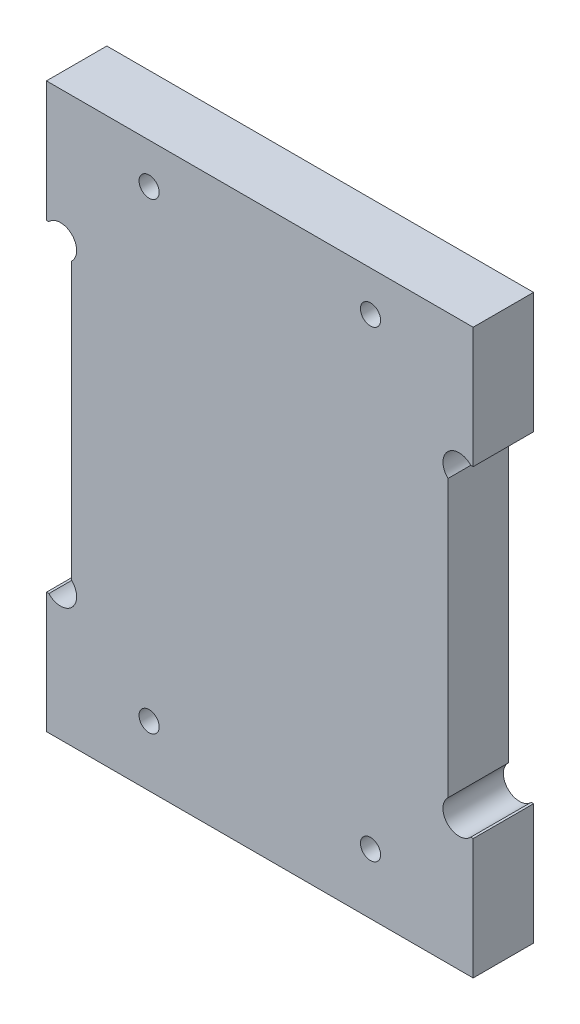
SolidWorks part; units mm, degrees
ref_plane "Plan de face" through (0, 0, 0) normal (0, 0, 1) x (1, 0, 0)
ref_plane "Plan de dessus" through (0, 0, 0) normal (0, 1, 0) x (1, 0, 0)
ref_plane "Plan de droite" through (0, 0, 0) normal (1, 0, 0) x (0, 0, -1)
sketch "Esquisse1" plane through (0, 0, 0) normal (0, 0, 1) x (1, 0, 0)
  line L0 (0, 41.289) -> (0, -35.1803) construction
  line L1 (-15, 27) -> (15, 27) construction
  line L2 (-15, 27) -> (-15, -27) construction
  line L3 (-15, -27) -> (15, -27) construction
  line L4 (15, 27) -> (15, -27) construction
  line L5 (-15, 27) -> (15, -27) construction
  line L6 (-15, -27) -> (15, 27) construction
  line L7 (-34.1389, 0) -> (26.846, 0) construction
  line L8 (-35.4491, -29) -> (54.1224, -29) construction
  line L9 (18.7, 32.9512) -> (18.7, -35.1803) construction
  line L10 (24.7, 34.7726) -> (24.7, -34.2274) construction
  line L11 (-23.2998, 27) -> (36.494, 27) construction
  line L12 (11, 15) -> (36.494, 15) construction
  line L13 (9.4444, -17) -> (55.5518, -17) construction
  line L14 (-24.7, 27) -> (24.7, 27)
  line L15 (24.7, 27) -> (24.7, 15)
  line L16 (24.7, 15) -> (20.9619, 15)
  line L17 (18.7, 12.7381) -> (18.7, -14.7381)
  line L18 (20.9619, -17) -> (24.7, -17)
  line L19 (24.7, -17) -> (24.7, -29)
  line L20 (24.7, -29) -> (-24.7, -29)
  line L21 (-24.7, 27) -> (-24.7, 15)
  line L22 (-24.7, 15) -> (-20.9619, 15)
  line L23 (-18.7, 12.7381) -> (-18.7, -14.7381)
  line L24 (-20.9619, -17) -> (-24.7, -17)
  line L25 (-24.7, -17) -> (-24.7, -29)
  circle A0 centre (-11, 23) radius 1
  circle A1 centre (11, 23) radius 1
  circle A2 centre (-11, -23) radius 1
  circle A3 centre (11, -23) radius 1
  arc A4 (20.9619, 15) -> (18.7, 12.7381) centre (19.8, 13.9) ccw
  arc A5 (18.7, -14.7381) -> (20.9619, -17) centre (19.8, -15.9) ccw
  arc A6 (-20.9619, 15) -> (-18.7, 12.7381) centre (-19.8, 13.9) cw
  arc A7 (-18.7, -14.7381) -> (-20.9619, -17) centre (-19.8, -15.9) cw
  point P0 (0, 0)
  point P50 (0, 27)
  point P53 (0, -29)
  dimension "D3" = 11
  dimension "D10" = 1.1
  dimension "D12" = 1.1
  dimension "D1" = 30
  dimension "D2" = 54
  dimension "D4" = 23
  dimension "D5" = 29
  dimension "D6" = 18.7
  dimension "D7" = 6
  dimension "D8" = 12
  dimension "D9" = 12
  dimension "D11" = 1.1
  dimension "D13" = 1.1
extrude "Boss.-Extru.1" add sketch "Esquisse1" along normal blind 6
sketch "Esquisse2" plane through (0, 0, 6) normal (0, 0, 1) x (1, 0, 0)
  line L0 (0, 30.4739) -> (0, -30.6393) construction
  line L2 (59.6443, 40.2839) -> (21.2, 40.2839)
  line L3 (59.6443, 40.2839) -> (59.6443, -39.7864)
  line L4 (59.6443, -39.7864) -> (21.2, -39.7864)
  line L5 (21.2, 40.2839) -> (21.2, -39.7864)
  line L6 (-50.0995, 38.8256) -> (-21.2, 38.8256)
  line L7 (-50.0995, 38.8256) -> (-50.0995, -41.2447)
  line L8 (-50.0995, -41.2447) -> (-21.2, -41.2447)
  line L9 (-21.2, 38.8256) -> (-21.2, -41.2447)
  line L11 (18.7, -14.7381) -> (18.7, 12.7381) construction
  line L12 (-18.7, 12.7381) -> (-18.7, -14.7381) construction
  dimension "D1" = 2.5
  dimension "D2" = 2.5
extrude "Enlèv. mat.-Extru.1" cut sketch "Esquisse2" against normal blind 10
sketch "Esquisse3" plane through (0, 0, 0) normal (0, 0, -1) x (-1, 0, 0)
  spline S1 degree 3 poles (5.5065, 13.8974) (5.2307, 5.063) (-6.0928, -0.5683) (-6.6304, 14.1008) (5.5065, 13.8974) (5.2307, 5.063) (-6.0928, -0.5683) knots -0.680453 -0.418242 -0.128168 0 0.319547 0.581758 0.871832 1 1.319547 1.581758 1.871832 only from (4.7307, 7.5029) to (4.7307, 7.5029)
  spline S2 degree 3 poles (9.3707, -14.3676) (8.1156, -6.415) (-5.997, -10.5174) (4.6661, -22.3233) (9.3707, -14.3676) (8.1156, -6.415) (-5.997, -10.5174) knots -0.692874 -0.381731 -0.160242 0 0.307126 0.618269 0.839758 1 1.307126 1.618269 1.839758 only from (7.4874, -9.0345) to (7.4874, -9.0345)
